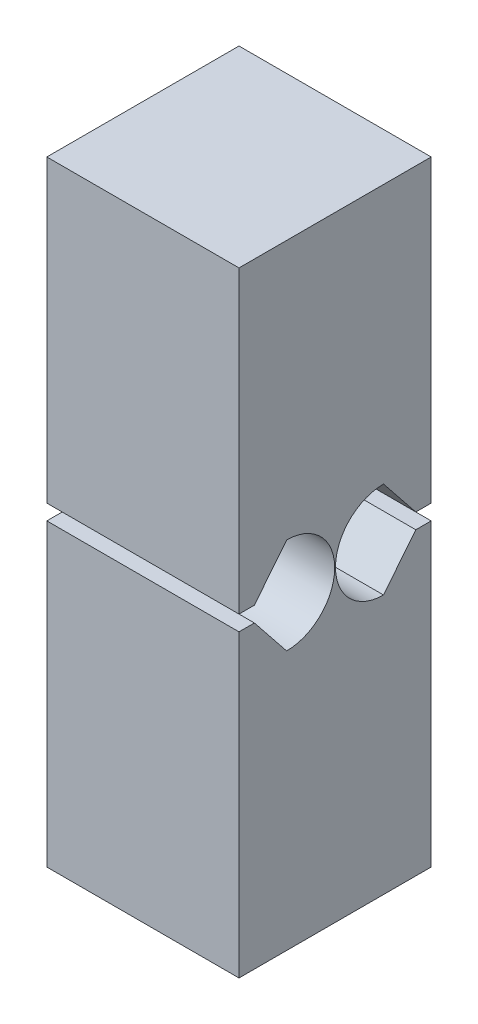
SolidWorks part; units mm, degrees
ref_plane "Front Plane" through (0, 0, 0) normal (0, 0, 1) x (1, 0, 0)
ref_plane "Top Plane" through (0, 0, 0) normal (0, 1, 0) x (1, 0, 0)
ref_plane "Right Plane" through (0, 0, 0) normal (1, 0, 0) x (0, 0, -1)
sketch "Sketch1" plane through (0, 0, 0) normal (0, 1, 0) x (1, 0, 0)
  line L1 (-3.175, 3.175) -> (3.175, 3.175)
  line L2 (-3.175, 3.175) -> (-3.175, -3.175)
  line L3 (-3.175, -3.175) -> (3.175, -3.175)
  line L4 (3.175, 3.175) -> (3.175, -3.175)
  dimension "D1" = 3.175
  dimension "D2" = 3.175
  dimension "D3" = 3.175
  dimension "D4" = 3.175
extrude "Boss-Extrude1" add sketch "Sketch1" along normal mid plane 20.32
sketch "Sketch2" plane through (3.175, 0, 0) normal (1, 0, 0) x (0, 0, -1)
  line L0 (-3.175, 0.254) -> (-3.175, -0.254)
  line L1 (-3.175, 10.16) -> (-3.175, -10.16) construction
  line L2 (-3.175, -0.254) -> (-2.667, -0.254)
  line L3 (-2.667, -0.254) -> (-1.6002, -1.5875)
  line L4 (-3.175, 0.254) -> (-2.667, 0.254)
  line L5 (-2.667, 0.254) -> (-1.6002, 1.5875)
  arc A0 (-1.6002, 1.5875) -> (-1.6002, -1.5875) centre (-1.6002, 0) cw
  dimension "D1" = 0.254
  dimension "D2" = 0.254
  dimension "D3" = 0.508
  dimension "D4" = 0.508
extrude "Cut-Extrude1" cut sketch "Sketch2" against normal up to next
mirror "Mirror1" about plane through (0, 0, 0) normal (0, 0, 1) of "Cut-Extrude1"
